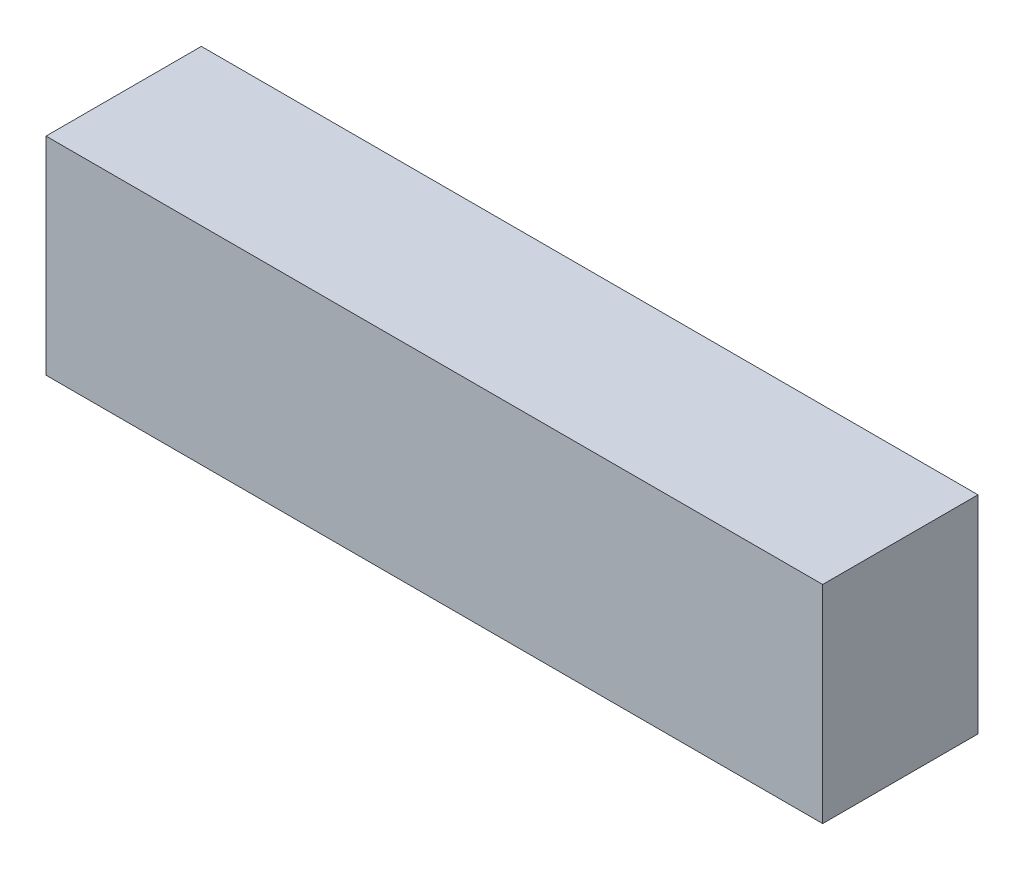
SolidWorks part; units mm, degrees
ref_plane "Front Plane" through (0, 0, 0) normal (0, 0, 1) x (1, 0, 0)
ref_plane "Top Plane" through (0, 0, 0) normal (0, 1, 0) x (1, 0, 0)
ref_plane "Right Plane" through (0, 0, 0) normal (1, 0, 0) x (0, 0, -1)
sketch "Sketch1" plane through (0, 0, 0) normal (0, 0, 1) x (1, 0, 0)
  line L1 (-95.25, 25.4) -> (95.25, 25.4)
  line L2 (-95.25, 25.4) -> (-95.25, -25.4)
  line L3 (-95.25, -25.4) -> (95.25, -25.4)
  line L4 (95.25, 25.4) -> (95.25, -25.4)
  line L5 (-95.25, 25.4) -> (95.25, -25.4) construction
  line L6 (-95.25, -25.4) -> (95.25, 25.4) construction
  point P0 (0, 0)
  dimension "D1" = 50.8
  dimension "D2" = 190.5
extrude "Boss-Extrude1" add sketch "Sketch1" along normal blind 38.1
